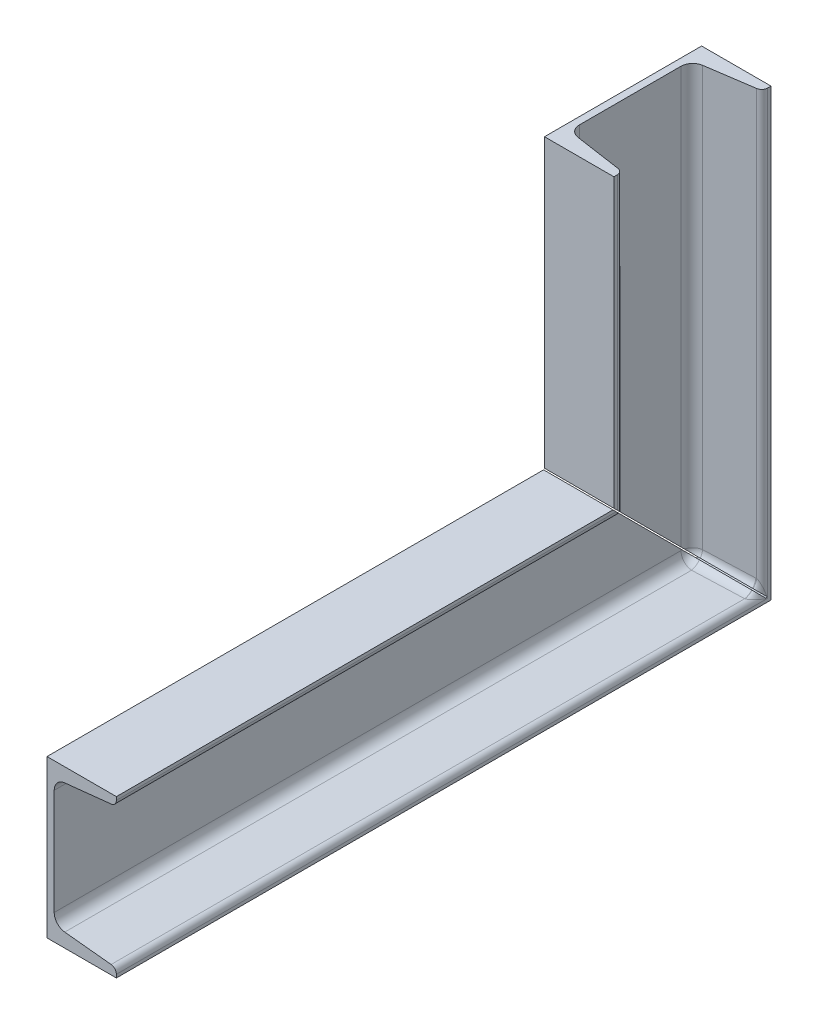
SolidWorks part; units mm, degrees
ref_plane "前视基准面" through (0, 0, 0) normal (0, 0, 1) x (1, 0, 0)
ref_plane "上视基准面" through (0, 0, 0) normal (0, 1, 0) x (1, 0, 0)
ref_plane "右视基准面" through (0, 0, 0) normal (1, 0, 0) x (0, 0, -1)
sketch "草图1" plane through (0, 0, 0) normal (0, 0, 1) x (1, 0, 0)
  line L0 (0, 60) -> (0, -60)
  line L1 (0, -60) -> (53, -60)
  line L2 (53, -60) -> (53, -53.5)
  line L3 (53, -53.5) -> (5.5, -48.5)
  line L4 (5.5, -48.5) -> (5.5, 48.5)
  line L5 (5.5, 48.5) -> (53, 53.5)
  line L6 (53, 53.5) -> (53, 60)
  line L7 (53, 60) -> (0, 60)
  line L8 (29.25, 60) -> (29.25, 51) construction
  line L9 (29.25, -51) -> (29.25, -60) construction
  dimension "D1" = 120
  dimension "D2" = 60
  dimension "D3" = 53
  dimension "D4" = 5.5
  dimension "D5" = 6.5
  dimension "D6" = 6.5
  dimension "D7" = 23.75
  dimension "D8" = 9
  dimension "D9" = 9
extrude "拉伸1" add sketch "草图1" along normal blind 500
fillet "圆角1" radius 4.5 2 edges at (53, -53.5, 250) (53, 53.5, 250)
sketch "草图2" plane through (0, -60, 0) normal (0, -1, 0) x (1, 0, 0)
  line L0 (0, 0) -> (0, 120)
  line L1 (0, 500) -> (0, 0) construction
  line L2 (0, 120) -> (53, 120)
  line L3 (53, 500) -> (53, 0) construction
  line L4 (53, 120) -> (53, 117.3854)
  line L5 (49.1561, 112.9335) -> (13.1879, 107.6329)
  line L6 (5.5, 98.7291) -> (5.5, 21.2709)
  line L7 (13.1879, 12.3671) -> (49.1561, 7.0665)
  line L8 (53, 2.6146) -> (53, 0)
  line L9 (53, 0) -> (0, 0)
  line L10 (29.25, 120) -> (29.25, 110) construction
  line L11 (29.25, 10) -> (29.25, 0) construction
  arc A0 (13.1879, 107.6329) -> (5.5, 98.7291) centre (14.5, 98.7291) ccw
  arc A1 (5.5, 21.2709) -> (13.1879, 12.3671) centre (14.5, 21.2709) ccw
  arc A2 (53, 117.3854) -> (49.1561, 112.9335) centre (48.5, 117.3854) cw
  arc A3 (49.1561, 7.0665) -> (53, 2.6146) centre (48.5, 2.6146) cw
  point P24 (53, 113.5)
  point P27 (53, 6.5)
  dimension "D8" = 9
  dimension "D9" = 4.5
  dimension "D1" = 120
  dimension "D2" = 6.5
  dimension "D3" = 6.5
  dimension "D4" = 23.75
  dimension "D5" = 5.5
  dimension "D6" = 10
  dimension "D7" = 10
extrude "拉伸2" add sketch "草图2" against normal blind 340
sketch "草图3" plane through (0, 0, 500) normal (0, 0, 1) x (1, 0, 0)
  line L0 (53, 57.5512) -> (53, -57.5512)
  line L8 (53, -60) -> (53, -57.5512)
  line L9 (48.9711, -53.0759) -> (5.5, -48.5)
  line L10 (5.5, -48.5) -> (5.5, 48.5)
  line L11 (5.5, 48.5) -> (48.9711, 53.0759)
  line L12 (53, 57.5512) -> (53, 60)
  line L13 (53, 60) -> (0, 60)
  line L14 (0, 60) -> (0, -60)
  line L15 (0, -60) -> (53, -60)
  line L17 (48.9711, -53.0759) -> (5.5, -48.5)
  line L18 (5.5, -48.5) -> (5.5, 48.5)
  line L19 (5.5, 48.5) -> (48.9711, 53.0759)
  arc A2 (53, -57.5512) -> (48.9711, -53.0759) centre (48.5, -57.5512) ccw
  arc A3 (48.9711, 53.0759) -> (53, 57.5512) centre (48.5, 57.5512) ccw
  arc A4 (53, -57.5512) -> (48.9711, -53.0759) centre (48.5, -57.5512) ccw
  arc A5 (48.9711, 53.0759) -> (53, 57.5512) centre (48.5, 57.5512) ccw
  dimension "D1" = 0
extrude "切除-拉伸1" cut sketch "草图3" against normal blind 450
fillet "圆角2" radius 9 10 edges at (51.906, -54.6103, 5.5554) (49.0637, -53.0866, 7.0801) (31.0795, -51.1926, 9.7304) (7.6879, -48.7303, 15.3891) (51.906, 54.6103, 5.5554) (49.0637, 53.0866, 7.0801) (31.0795, 51.1926, 9.7304) (7.6879, 48.7303, 15.3891) (5.5, -48.5, 260.6354) (5.5, 48.5, 260.6354)
sketch "草图4" plane through (0, 280, 0) normal (0, 1, 0) x (-1, 0, 0)
  line L0 (-53, 2.6146) -> (-53, 117.3854)
  line L8 (-53, 0) -> (0, 0)
  line L9 (0, 0) -> (0, 120)
  line L10 (0, 120) -> (-53, 120)
  line L11 (-53, 120) -> (-53, 117.3854)
  line L12 (-49.1561, 112.9335) -> (-13.1879, 107.6329)
  line L13 (-5.5, 98.7291) -> (-5.5, 21.2709)
  line L14 (-13.1879, 12.3671) -> (-49.1561, 7.0665)
  line L15 (-53, 2.6146) -> (-53, 0)
  line L20 (-49.1561, 112.9335) -> (-13.1879, 107.6329)
  line L21 (-5.5, 98.7291) -> (-5.5, 21.2709)
  line L22 (-13.1879, 12.3671) -> (-49.1561, 7.0665)
  arc A4 (-53, 117.3854) -> (-49.1561, 112.9335) centre (-48.5, 117.3854) ccw
  arc A5 (-5.5, 98.7291) -> (-13.1879, 107.6329) centre (-14.5, 98.7291) ccw
  arc A6 (-13.1879, 12.3671) -> (-5.5, 21.2709) centre (-14.5, 21.2709) ccw
  arc A7 (-49.1561, 7.0665) -> (-53, 2.6146) centre (-48.5, 2.6146) ccw
  arc A8 (-53, 117.3854) -> (-49.1561, 112.9335) centre (-48.5, 117.3854) ccw
  arc A9 (-5.5, 98.7291) -> (-13.1879, 107.6329) centre (-14.5, 98.7291) ccw
  arc A10 (-13.1879, 12.3671) -> (-5.5, 21.2709) centre (-14.5, 21.2709) ccw
  arc A11 (-49.1561, 7.0665) -> (-53, 2.6146) centre (-48.5, 2.6146) ccw
  dimension "D1" = 0
extrude "切除-拉伸2" cut sketch "草图4" against normal blind 300
sketch "草图5" plane through (0, 0, 0) normal (-1, 0, 0) x (0, 0, 1)
  line L0 (0, -60) -> (120, 60) construction
  line L1 (130.9135, 71.6206) -> (3.134, -56.1589)
  line L2 (3.134, -56.1589) -> (3.8411, -56.866)
  line L3 (3.8411, -56.866) -> (131.6206, 70.9135)
  line L4 (131.6206, 70.9135) -> (130.9135, 71.6206)
  dimension "D1" = 0.5
  dimension "D2" = 1
extrude "切除-拉伸3" cut sketch "草图5" against normal blind 300
